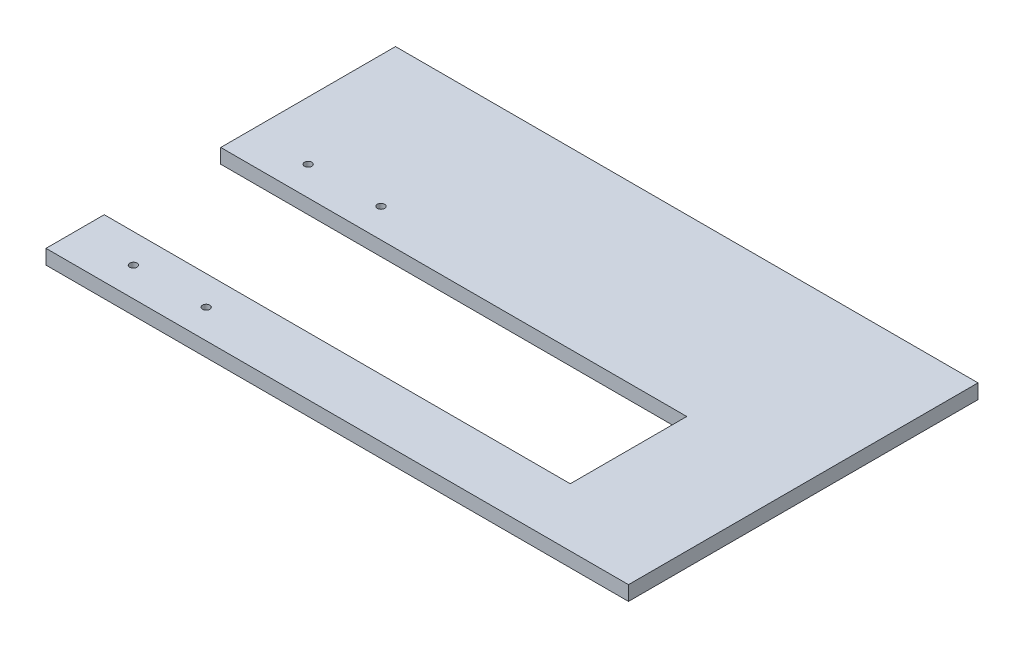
SolidWorks part; units mm, degrees
ref_plane "Front Plane" through (0, 0, 0) normal (0, 0, 1) x (1, 0, 0)
ref_plane "Top Plane" through (0, 0, 0) normal (0, 1, 0) x (1, 0, 0)
ref_plane "Right Plane" through (0, 0, 0) normal (1, 0, 0) x (0, 0, -1)
sketch "Sketch1" plane through (0, 0, 0) normal (0, 1, 0) x (1, 0, 0)
  line L1 (0, 0) -> (254, 0)
  line L2 (0, 0) -> (0, 152.4)
  line L3 (0, 152.4) -> (254, 152.4)
  line L4 (254, 0) -> (254, 152.4)
  dimension "D1" = 254
  dimension "D2" = 152.4
extrude "Boss-Extrude1" add sketch "Sketch1" along normal blind 6.35 contours L3 L4 L1 L2
sketch "Sketch3" plane through (0, 6.35, 0) normal (0, 1, 0) x (1, 0, 0)
  line L1 (0, 76.2) -> (203.2, 76.2)
  line L2 (0, 76.2) -> (0, 25.4)
  line L3 (0, 25.4) -> (203.2, 25.4)
  line L4 (203.2, 76.2) -> (203.2, 25.4)
  line L5 (254, 0) -> (254, 152.4) construction
  line L6 (0, 0) -> (0, 152.4) construction
  line L7 (0, 0) -> (254, 0) construction
  dimension "D1" = 50.8
  dimension "D2" = 50.8
  dimension "D3" = 0
  dimension "D4" = 25.4
extrude "Cut-Extrude1" cut sketch "Sketch3" against normal blind 6.35
sketch "Sketch4" plane through (0, 6.35, 0) normal (0, 1, 0) x (1, 0, 0)
  line L0 (203.2, 76.2) -> (0, 76.2) construction
  line L1 (203.2, 25.4) -> (203.2, 76.2) construction
  line L2 (0, 25.4) -> (203.2, 25.4) construction
  circle A0 centre (25.4, 88.9) radius 1.5875
  circle A1 centre (57.15, 88.9) radius 1.5875
  circle A2 centre (25.4, 12.7) radius 1.5875
  circle A3 centre (57.15, 12.7) radius 1.5875
  point P14 (62.9921, 12.7)
  dimension "D1" = 3.175
  dimension "D2" = 3.175
  dimension "D3" = 31.75
  dimension "D4" = 0
  dimension "D5" = 12.7
  dimension "D6" = 146.05
  dimension "D7" = 3.175
  dimension "D8" = 3.175
  dimension "D9" = 12.7
  dimension "D10" = 12.7
  dimension "D11" = 31.75
  dimension "D12" = 0
extrude "Cut-Extrude2" cut sketch "Sketch4" against normal blind 25.4
